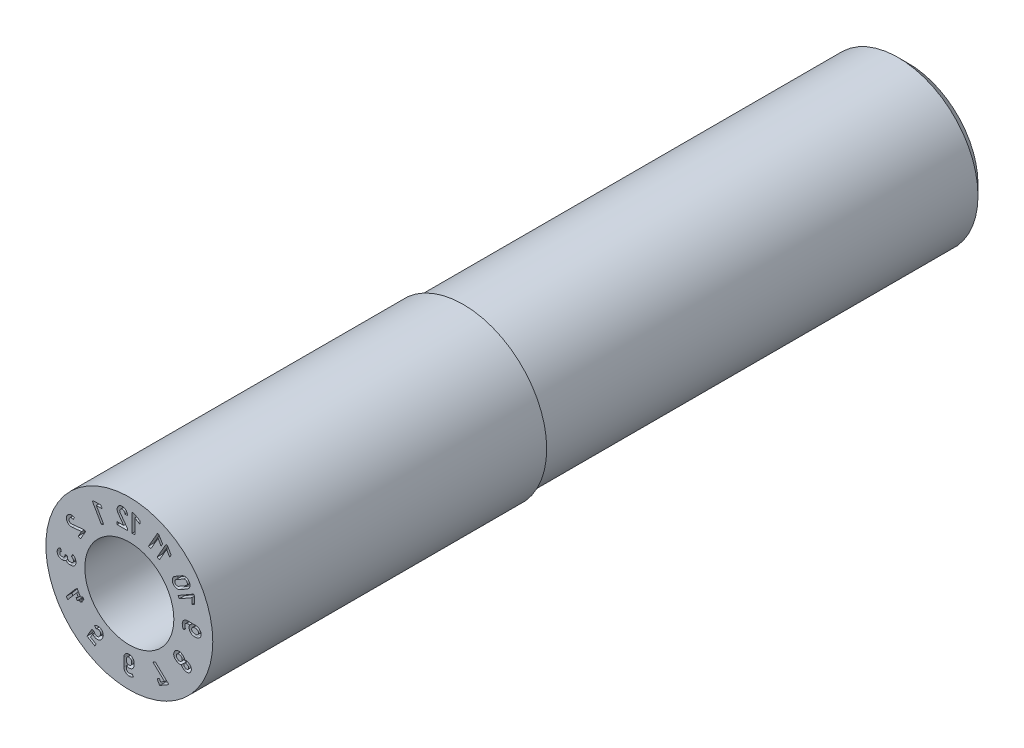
SolidWorks part; units mm, degrees
ref_plane "Front Plane" through (0, 0, 0) normal (0, 0, 1) x (1, 0, 0)
ref_plane "Top Plane" through (0, 0, 0) normal (0, 1, 0) x (1, 0, 0)
ref_plane "Right Plane" through (0, 0, 0) normal (1, 0, 0) x (0, 0, -1)
sketch "Sketch1" plane through (0, 0, 0) normal (1, 0, 0) x (0, 0, -1)
  line L2 (0, 1.5) -> (0, 0.8)
  line L3 (13.75, 1.5) -> (0, 1.5)
  line L4 (-3.7979, 0) -> (49996.2021, 0) construction
  line L8 (11, 0.6) -> (2.2, 0.6)
  line L9 (2.2, 0.8) -> (2.2, 0.6)
  line L10 (2.2, 0.8) -> (0, 0.8)
  line L12 (14, 1) -> (14, 1.25)
  line L16 (14, 1.25) -> (13.75, 1.5)
  line L17 (14, 1) -> (11, 1)
  line L18 (11, 0.6) -> (11, 1)
  dimension "D1" = 14
  dimension "D2" = 45
  dimension "D3" = 0.25
  dimension "D4" = 3
  dimension "D5" = 1.6
  dimension "D6" = 2.2
  dimension "D7" = 1.2
  dimension "D8" = 2
  dimension "D9" = 3
revolve "Revolve1" add sketch "Sketch1" angle 360 about L4
sketch "Sketch5" plane through (0, 0, 0) normal (1, 0, 0) x (0, 0, -1)
  line L0 (0, 0) -> (50000, 0) construction
  line L1 (0, 1.5) -> (0, -1.5) construction
  line L2 (6, 1.435) -> (14, 1.435)
  line L3 (6, 1.435) -> (6, 2.435)
  line L4 (6, 2.435) -> (14, 2.435)
  line L5 (14, 1.435) -> (14, 2.435)
  line L6 (14, -1.25) -> (14, 1.25) construction
  line L7 (13.75, 1.5) -> (0, 1.5) construction
  dimension "D1" = 6
  dimension "D2" = 0.065
  dimension "D3" = 1
revolve "Cut-Revolve1" cut sketch "Sketch5" angle 360 about L0
sketch "Sketch2" plane through (0, 0, 0) normal (0, 0, 1) x (1, 0, 0)
  line L0 (0.662, 1.0978) -> (0.6884, 1.0825)
  line L1 (0.6884, 1.0825) -> (0.7512, 0.9742)
  line L2 (0.7512, 0.9742) -> (0.7245, 0.9278)
  line L3 (0.7245, 0.9278) -> (0.6708, 1.0204)
  line L4 (0.6708, 1.0204) -> (0.5398, 0.7935)
  line L5 (0.5398, 0.7935) -> (0.4997, 0.8167)
  line L6 (0.4997, 0.8167) -> (0.662, 1.0978)
  line L7 (0.5083, 1.1928) -> (0.5347, 1.1775)
  line L8 (0.5347, 1.1775) -> (0.5975, 1.0692)
  line L9 (0.5975, 1.0692) -> (0.5708, 1.0229)
  line L10 (0.5708, 1.0229) -> (0.5171, 1.1154)
  line L11 (0.5171, 1.1154) -> (0.3862, 0.8886)
  line L12 (0.3862, 0.8886) -> (0.346, 0.9117)
  line L13 (0.346, 0.9117) -> (0.5083, 1.1928)
  line L14 (0.8877, 0.5559) -> (1.0203, 0.6324)
  line L15 (0.9739, 0.7127) -> (0.8414, 0.6362)
  line L16 (1.1968, 0.0529) -> (1.1666, 0.0529)
  line L17 (1.1666, -0.0398) -> (1.1967, -0.0398)
  line L18 (1.1968, 0.0993) -> (1.0437, 0.0993)
  line L19 (0.9729, -0.0723) -> (1.0127, -0.0484)
  line L20 (1.1967, -0.0862) -> (1.1666, -0.0863)
  line L21 (1.0863, 0.0529) -> (1.0437, 0.0529)
  line L22 (0.9982, -0.6493) -> (1.0122, -0.6574)
  line L23 (1.0493, -0.5931) -> (1.0353, -0.585)
  line L24 (0.4233, -0.8536) -> (0.4652, -0.8294)
  line L25 (0.4652, -0.8294) -> (0.6949, -1.0459)
  line L26 (0.6949, -1.0459) -> (0.706, -1.0652)
  line L27 (0.706, -1.0652) -> (0.5454, -1.1579)
  line L28 (0.5454, -1.1579) -> (0.499, -1.0776)
  line L29 (0.499, -1.0776) -> (0.5392, -1.0544)
  line L30 (0.5392, -1.0544) -> (0.5623, -1.0946)
  line L31 (0.5623, -1.0946) -> (0.6346, -1.0528)
  line L32 (0.6346, -1.0528) -> (0.4233, -0.8536)
  line L33 (0.8671, -0.5843) -> (0.8811, -0.5924)
  line L34 (0.9275, -0.5121) -> (0.9134, -0.504)
  line L35 (0.9507, -0.4719) -> (0.9366, -0.4638)
  line L36 (0.8439, -0.6244) -> (0.8579, -0.6325)
  line L37 (0.975, -0.6894) -> (0.989, -0.6975)
  line L38 (1.0725, -0.553) -> (1.0585, -0.5449)
  line L39 (1.1554, 0.5691) -> (1.1707, 0.5427)
  line L40 (1.1707, 0.5427) -> (1.1709, 0.4174)
  line L41 (1.1709, 0.4174) -> (1.1246, 0.3907)
  line L42 (1.1246, 0.3907) -> (1.1244, 0.4977)
  line L43 (1.1244, 0.4977) -> (0.8976, 0.3667)
  line L44 (0.8976, 0.3667) -> (0.8744, 0.4068)
  line L45 (0.8744, 0.4068) -> (1.1554, 0.5691)
  line L46 (0.9507, 0.7528) -> (0.8182, 0.6763)
  line L47 (0.9109, 0.5157) -> (1.0434, 0.5922)
  line L48 (0.0526, 1.2883) -> (0.0831, 1.2883)
  line L49 (0.0831, 1.2883) -> (0.1917, 1.2258)
  line L50 (0.1917, 1.2258) -> (0.1917, 1.1724)
  line L51 (0.1917, 1.1724) -> (0.0989, 1.2257)
  line L52 (0.0989, 1.2257) -> (0.0989, 0.9637)
  line L53 (0.0989, 0.9637) -> (0.0526, 0.9637)
  line L54 (0.0526, 0.9637) -> (0.0526, 1.2883)
  line L55 (-0.2185, 0.963) -> (-0.033, 0.963)
  line L56 (-0.033, 0.963) -> (-0.033, 0.9937)
  line L57 (-0.033, 0.9937) -> (-0.1634, 1.1747)
  line L58 (-0.0799, 1.1948) -> (-0.0333, 1.1948)
  line L59 (-0.2011, 1.1475) -> (-0.1003, 1.0094)
  line L60 (-0.1003, 1.0094) -> (-0.2185, 1.0094)
  line L61 (-0.2185, 1.0094) -> (-0.2185, 0.963)
  line L62 (-0.6645, 1.1049) -> (-0.6381, 1.1202)
  line L63 (-0.6381, 1.1202) -> (-0.5128, 1.1204)
  line L64 (-0.5128, 1.1204) -> (-0.4861, 1.0741)
  line L65 (-0.4861, 1.0741) -> (-0.5931, 1.0739)
  line L66 (-0.5931, 1.0739) -> (-0.4621, 0.847)
  line L67 (-0.4621, 0.847) -> (-0.5022, 0.8238)
  line L68 (-0.5022, 0.8238) -> (-0.6645, 1.1049)
  line L69 (-0.0519, -1.0403) -> (-0.0519, -1.0705)
  line L70 (0.0408, -1.0705) -> (0.0408, -1.0403)
  line L71 (0.0871, -1.0404) -> (0.0872, -1.0705)
  line L72 (-0.0519, -1.1508) -> (-0.0519, -1.1933)
  line L73 (-0.0983, -1.0403) -> (-0.0983, -1.1933)
  line L74 (0.0732, -1.2642) -> (0.0493, -1.2244)
  line L75 (-0.4806, -0.93) -> (-0.4956, -0.956)
  line L76 (-0.6706, -0.8882) -> (-0.6304, -0.9113)
  line L77 (-0.5358, -0.9329) -> (-0.5207, -0.9068)
  line L78 (-0.5975, -0.8479) -> (-0.6264, -0.8116)
  line L79 (-0.6706, -0.8882) -> (-0.7605, -1.044)
  line L80 (-0.7605, -1.044) -> (-0.62, -1.1252)
  line L81 (-0.62, -1.1252) -> (-0.5968, -1.085)
  line L82 (-0.5968, -1.085) -> (-0.6972, -1.0271)
  line L83 (-0.6972, -1.0271) -> (-0.6576, -0.9585)
  line L84 (-1.2131, -0.0767) -> (-1.1969, -0.0767)
  line L85 (-1.067, -0.086) -> (-1.0508, -0.086)
  line L86 (-1.0212, 0.0995) -> (-1.0382, 0.0564)
  line L87 (-1.2366, 0.0902) -> (-1.2218, 0.0463)
  line L88 (-1.2131, -0.0303) -> (-1.1969, -0.0303)
  line L89 (-1.1598, 0.0068) -> (-1.1598, 0.0299)
  line L90 (-1.1598, 0.0299) -> (-1.1134, 0.0299)
  line L91 (-1.1134, 0.0299) -> (-1.1134, 0.0068)
  line L92 (-1.067, -0.0396) -> (-1.0508, -0.0396)
  line L93 (-1.1329, -0.6083) -> (-1.1083, -0.6508)
  line L94 (-1.1083, -0.6508) -> (-0.9481, -0.4646)
  line L95 (-0.9481, -0.4646) -> (-0.9181, -0.5166)
  line L96 (-0.9181, -0.5166) -> (-0.9582, -0.5398)
  line L97 (-0.9582, -0.5398) -> (-0.935, -0.58)
  line L98 (-0.935, -0.58) -> (-0.8949, -0.5568)
  line L99 (-0.8949, -0.5568) -> (-0.8833, -0.5769)
  line L100 (-0.8833, -0.5769) -> (-0.8432, -0.5537)
  line L101 (-0.8432, -0.5537) -> (-0.8547, -0.5336)
  line L102 (-0.8547, -0.5336) -> (-0.8146, -0.5104)
  line L103 (-0.8146, -0.5104) -> (-0.8378, -0.4703)
  line L104 (-0.8378, -0.4703) -> (-0.8779, -0.4934)
  line L105 (-0.8779, -0.4934) -> (-0.9359, -0.3931)
  line L106 (-0.9359, -0.3931) -> (-0.9594, -0.4066)
  line L107 (-0.9594, -0.4066) -> (-1.1329, -0.6083)
  line L108 (-0.9175, 0.4337) -> (-0.8773, 0.4105)
  line L109 (-0.8773, 0.4105) -> (-0.7846, 0.5711)
  line L110 (-0.7846, 0.5711) -> (-0.8111, 0.5864)
  line L111 (-0.8111, 0.5864) -> (-1.0331, 0.564)
  line L112 (-1.0088, 0.6464) -> (-0.9855, 0.6868)
  line L113 (-1.0284, 0.5178) -> (-0.8584, 0.5361)
  line L114 (-0.8584, 0.5361) -> (-0.9175, 0.4337)
  arc A0 (0.8414, 0.6362) -> (0.8877, 0.5559) centre (0.8646, 0.596) ccw
  arc A1 (1.0203, 0.6324) -> (0.9739, 0.7127) centre (0.9971, 0.6725) ccw
  arc A2 (1.1666, 0.0529) -> (1.1666, -0.0398) centre (1.1666, 0.0065) ccw
  arc A3 (1.1967, -0.0398) -> (1.1968, 0.0529) centre (1.1967, 0.0065) ccw
  arc A4 (1.0437, 0.0993) -> (0.951, 0.0065) centre (1.0438, 0.0065) ccw
  arc A5 (0.951, 0.0065) -> (0.9729, -0.0723) centre (1.1039, 0.0065) ccw
  arc A6 (1.1967, -0.0862) -> (1.1968, 0.0993) centre (1.1967, 0.0065) ccw
  arc A7 (1.0863, 0.0529) -> (1.1666, -0.0863) centre (1.1663, 0.0063) ccw
  arc A8 (1.0437, 0.0529) -> (0.9975, 0.0101) centre (1.0437, 0.0065) ccw
  arc A9 (0.9975, 0.0101) -> (1.0127, -0.0484) centre (1.0903, 0.003) ccw
  arc A10 (1.0353, -0.585) -> (0.9982, -0.6493) centre (1.0167, -0.6171) ccw
  arc A11 (1.0122, -0.6574) -> (1.0493, -0.5931) centre (1.0308, -0.6253) ccw
  arc A12 (0.9134, -0.504) -> (0.8671, -0.5843) centre (0.8903, -0.5441) ccw
  arc A13 (0.8811, -0.5924) -> (0.9275, -0.5121) centre (0.9043, -0.5522) ccw
  arc A14 (0.9957, -0.5364) -> (0.9507, -0.4719) centre (0.9043, -0.5522) ccw
  arc A15 (0.9366, -0.4638) -> (0.8439, -0.6244) centre (0.8902, -0.5441) ccw
  arc A16 (0.8579, -0.6325) -> (0.9362, -0.6393) centre (0.9043, -0.5522) ccw
  arc A17 (0.9362, -0.6393) -> (0.975, -0.6894) centre (1.0168, -0.6171) ccw
  arc A18 (0.989, -0.6975) -> (1.0725, -0.553) centre (1.0308, -0.6253) ccw
  arc A19 (1.0585, -0.5449) -> (0.9957, -0.5364) centre (1.0168, -0.6164) ccw
  arc A20 (0.8182, 0.6763) -> (0.9109, 0.5157) centre (0.8646, 0.596) ccw
  arc A21 (1.0434, 0.5922) -> (0.9507, 0.7528) centre (0.9971, 0.6725) ccw
  arc A22 (-0.0799, 1.1948) -> (-0.1634, 1.1747) centre (-0.1258, 1.2018) ccw
  arc A23 (-0.0333, 1.1948) -> (-0.2011, 1.1475) centre (-0.1258, 1.2017) ccw
  arc A24 (-0.0519, -1.0705) -> (0.0408, -1.0705) centre (-0.0056, -1.0705) ccw
  arc A25 (0.0408, -1.0403) -> (-0.0519, -1.0403) centre (-0.0056, -1.0403) ccw
  arc A26 (0.0871, -1.0404) -> (-0.0983, -1.0403) centre (-0.0056, -1.0403) ccw
  arc A27 (-0.0519, -1.1508) -> (0.0872, -1.0705) centre (-0.0053, -1.0708) ccw
  arc A28 (-0.0519, -1.1933) -> (-0.0091, -1.2396) centre (-0.0056, -1.1933) ccw
  arc A29 (-0.0091, -1.2396) -> (0.0493, -1.2244) centre (-0.002, -1.1468) ccw
  arc A30 (-0.0983, -1.1933) -> (-0.0056, -1.2861) centre (-0.0056, -1.1933) ccw
  arc A31 (-0.0056, -1.2861) -> (0.0732, -1.2642) centre (-0.0055, -1.1332) ccw
  arc A32 (-0.6223, -0.99) -> (-0.4956, -0.956) centre (-0.576, -0.9095) ccw
  arc A33 (-0.6576, -0.9585) -> (-0.6223, -0.99) centre (-0.565, -0.8904) ccw
  arc A34 (-0.4806, -0.93) -> (-0.5145, -0.8033) centre (-0.5609, -0.8836) ccw
  arc A35 (-0.5145, -0.8033) -> (-0.6264, -0.8116) centre (-0.5644, -0.8895) ccw
  arc A36 (-0.6304, -0.9113) -> (-0.5991, -0.9499) centre (-0.5643, -0.8896) ccw
  arc A37 (-0.5991, -0.9499) -> (-0.5358, -0.9329) centre (-0.5759, -0.9097) ccw
  arc A38 (-0.5207, -0.9068) -> (-0.5377, -0.8435) centre (-0.5608, -0.8836) ccw
  arc A39 (-0.5377, -0.8435) -> (-0.5975, -0.8479) centre (-0.5643, -0.8897) ccw
  arc A40 (-1.2366, 0.0902) -> (-1.2965, 0.0068) centre (-1.2084, 0.0068) ccw
  arc A41 (-1.2965, 0.0068) -> (-1.2131, -0.0767) centre (-1.2131, 0.0068) ccw
  arc A42 (-1.1969, -0.0767) -> (-1.1382, -0.0526) centre (-1.1969, 0.0067) ccw
  arc A43 (-1.1382, -0.0526) -> (-1.067, -0.086) centre (-1.0671, 0.0067) ccw
  arc A44 (-1.0508, -0.086) -> (-0.9581, 0.0068) centre (-1.0508, 0.0067) ccw
  arc A45 (-0.9581, 0.0068) -> (-1.0212, 0.0995) centre (-1.0578, 0.0067) ccw
  arc A46 (-1.2218, 0.0463) -> (-1.2502, 0.0068) centre (-1.2085, 0.0068) ccw
  arc A47 (-1.2502, 0.0068) -> (-1.2131, -0.0303) centre (-1.213, 0.0068) ccw
  arc A48 (-1.1969, -0.0303) -> (-1.1598, 0.0068) centre (-1.1969, 0.0068) ccw
  arc A49 (-1.1134, 0.0068) -> (-1.067, -0.0396) centre (-1.067, 0.0068) ccw
  arc A50 (-1.0508, -0.0396) -> (-1.0044, 0.0068) centre (-1.0508, 0.0068) ccw
  arc A51 (-1.0044, 0.0068) -> (-1.0382, 0.0564) centre (-1.0578, 0.0068) ccw
  arc A52 (-1.0088, 0.6464) -> (-1.0331, 0.564) centre (-1.0378, 0.6102) ccw
  arc A53 (-0.9855, 0.6868) -> (-1.0284, 0.5178) centre (-1.0377, 0.6101) ccw
extrude "Cut-Extrude1" cut sketch "Sketch2" against normal blind 0.1
sketch "Sketch3" plane through (0, 0, -2.2) normal (0, 0, 1) x (1, 0, 0)
  line L0 (0, 0) -> (0, 50000) construction
  line L1 (0.3464, 0.6) -> (-0.3464, 0.6)
  line L2 (-0.3464, 0.6) -> (-0.6928, 0)
  line L3 (-0.6928, 0) -> (-0.3464, -0.6)
  line L4 (-0.3464, -0.6) -> (0.3464, -0.6)
  line L5 (0.3464, -0.6) -> (0.6928, 0)
  line L6 (0.6928, 0) -> (0.3464, 0.6)
  line L7 (0, 0) -> (50000, 0) construction
  circle A0 centre (0, 0) radius 0.6 construction
  circle A1 centre (0, 0) radius 0.6 construction
  dimension "D1" = 1.2
extrude "Cut-Extrude2" cut sketch "Sketch3" against normal blind 1.4
